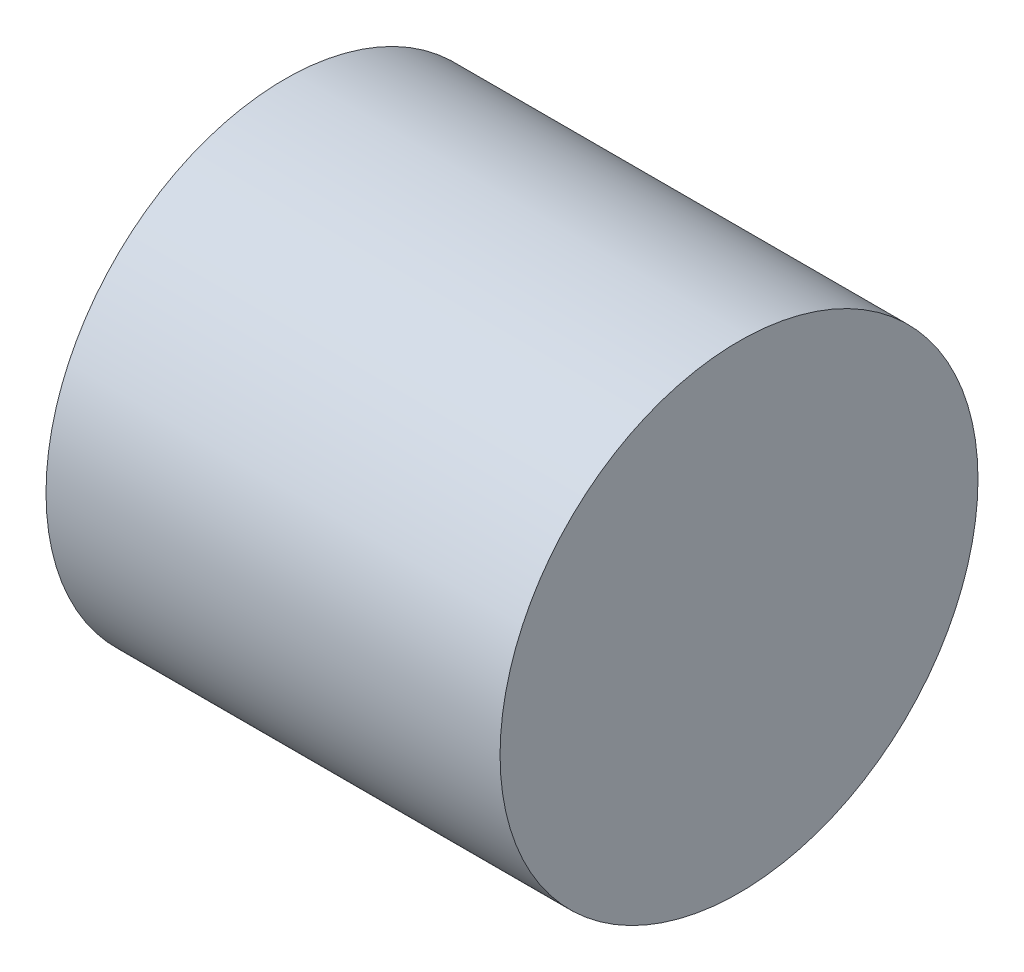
SolidWorks part; units mm, degrees
ref_plane "Plan de face" through (0, 0, 0) normal (0, 0, 1) x (1, 0, 0)
ref_plane "Plan de dessus" through (0, 0, 0) normal (0, 1, 0) x (1, 0, 0)
ref_plane "Plan de droite" through (0, 0, 0) normal (1, 0, 0) x (0, 0, -1)
sketch "Esquisse1" plane through (0, 0, 0) normal (1, 0, 0) x (0, 0, -1)
  circle A0 centre (0, 0) radius 50
  dimension "D1" = 100
extrude "Extrusion1" add sketch "Esquisse1" along normal mid plane 95
